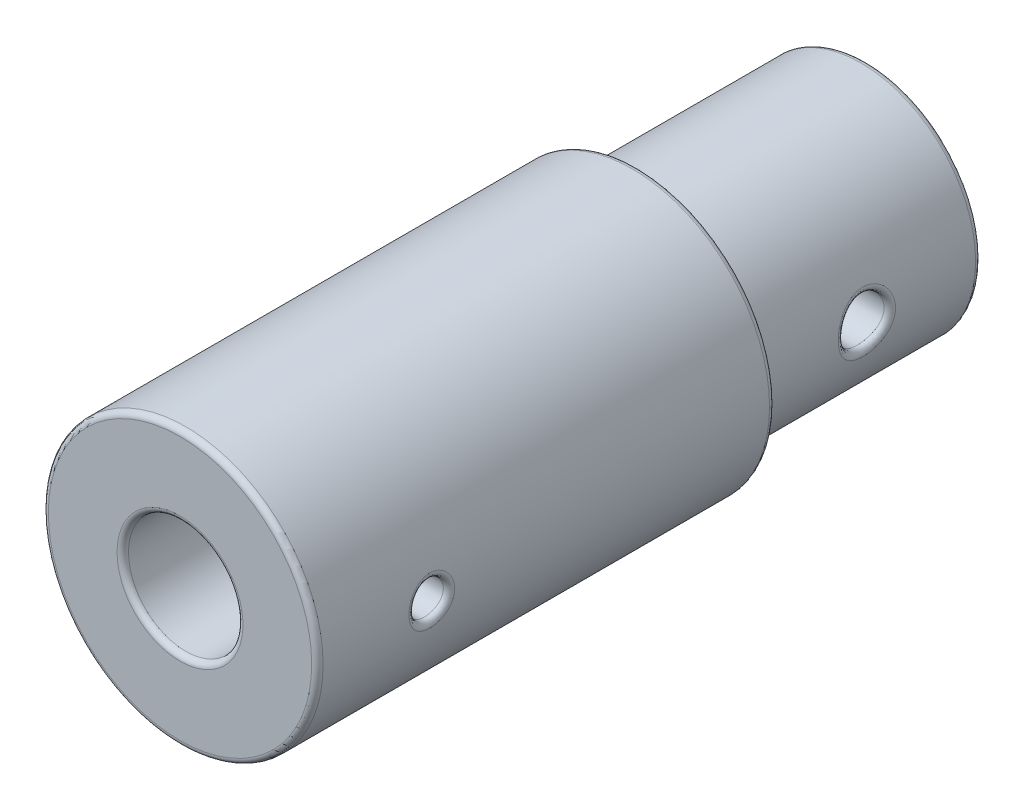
SolidWorks part; units mm, degrees
ref_plane "Спереди" through (0, 0, 0) normal (0, 0, 1) x (1, 0, 0)
ref_plane "Сверху" through (0, 0, 0) normal (0, 1, 0) x (1, 0, 0)
ref_plane "Справа" through (0, 0, 0) normal (1, 0, 0) x (0, 0, -1)
sketch "Эскиз1" plane through (0, 0, 0) normal (1, 0, 0) x (0, 0, -1)
  line L0 (0, 5) -> (16.9957, 5)
  line L1 (16.9957, 5) -> (20, 0)
  line L2 (20, 0) -> (57, 0)
  line L3 (57, 0) -> (57, 10)
  line L4 (57, 10) -> (37, 10)
  line L5 (37, 10) -> (37, 12)
  line L6 (37, 12) -> (0, 12)
  line L7 (0, 12) -> (0, 5)
  dimension "D1" = 10
  dimension "D2" = 12
  dimension "D3" = 5
  dimension "D4" = 59
  dimension "D5" = 37
  dimension "D6" = 20
  dimension "D7" = 20
revolve "Повернуть1" add sketch "Эскиз1" angle 360 about L2
sketch "Эскиз2" plane through (0, 0, 0) normal (1, 0, 0) x (0, 0, -1)
  line L0 (0, 12) -> (0, -12) construction
  line L1 (40, -10) -> (40, 10) construction
  circle A0 centre (10, 0) radius 1.5
  circle A1 centre (50, 0) radius 2
  dimension "D1" = 3
  dimension "D2" = 4
  dimension "D3" = 10
  dimension "D4" = 10
extrude "Вырез-Вытянуть1" cut sketch "Эскиз2" against normal mid plane 30
fillet "Скругление1" radius 0.5 12 edges at (10, 0, -60) (10, 0, -40) (9.9914, 0.4155, -48.0436) (-9.9914, -0.4155, -48.0436) (5, 0, 0) (5, 0, -16.9957) (4.9926, -0.2714, -8.5248) (-4.9926, 0.2714, -8.5248) (12, 0, -40) (12, 0, 0) (11.9954, 0.3319, -8.5372) (-11.9954, -0.3319, -8.5372)
